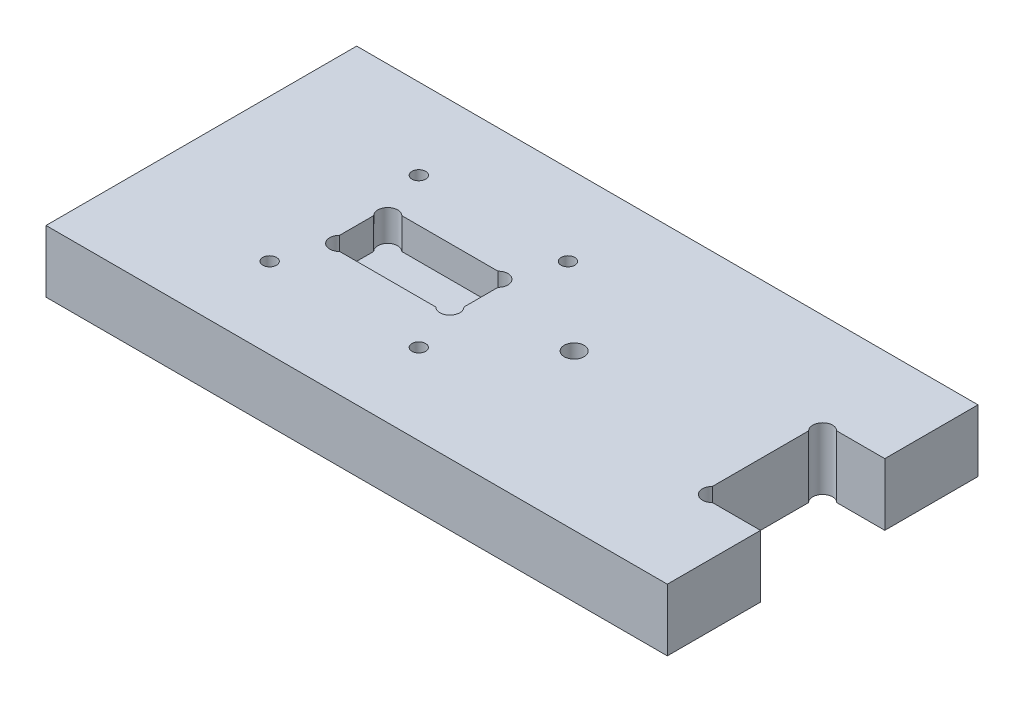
SolidWorks part; units mm, degrees
ref_plane "Plan de face" through (0, 0, 0) normal (0, 0, 1) x (1, 0, 0)
ref_plane "Plan de dessus" through (0, 0, 0) normal (0, 1, 0) x (1, 0, 0)
ref_plane "Plan de droite" through (0, 0, 0) normal (1, 0, 0) x (0, 0, -1)
sketch "Esquisse1" plane through (0, 0, 0) normal (0, 1, 0) x (1, 0, 0)
  line L0 (-29.0426, 0) -> (126.9149, 0) construction
  line L1 (0, -5.4255) -> (0, 79.2553) construction
  line L2 (-29.0426, 50) -> (126.9149, 50) construction
  line L3 (100, -5.4255) -> (100, 82.0213) construction
  line L4 (50, 70.3191) -> (50, 63.232) construction
  line L5 (-20.5319, 25) -> (71.7306, 25) construction
  line L6 (84.5024, 35) -> (116.1219, 35) construction
  line L7 (60, -5.4255) -> (60, 28.5588) construction
  line L8 (90, 67.7571) -> (90, -15.7213) construction
  line L9 (47, -15.7213) -> (47, 45.1283) construction
  line L10 (23, -15.7213) -> (23, 45.1283) construction
  line L11 (0, 50) -> (0, 0)
  line L12 (35, -5.4255) -> (35, 31.9737) construction
  line L13 (100, 35) -> (100, 50)
  line L14 (92.2627, 35) -> (100, 35)
  line L15 (0, 50) -> (100, 50)
  line L16 (0, 0) -> (100, 0)
  line L17 (92.2627, 15) -> (100, 15)
  line L18 (100, 15) -> (100, 0)
  line L19 (-5.892, 13) -> (50, 13) construction
  line L21 (90, 32.7373) -> (90, 17.2627)
  circle A0 centre (23, 13) radius 1.1
  circle A1 centre (47, 13) radius 1.1
  arc A2 (90, 17.2627) -> (92.2627, 15) centre (91.1314, 16.1314) ccw
  arc A3 (90, 32.7373) -> (92.2627, 35) centre (91.1314, 33.8686) cw
  circle A4 centre (47, 37) radius 1.1
  circle A5 centre (23, 37) radius 1.1
  circle A6 centre (60, 25) radius 1.6
  dimension "D10" = 12
  dimension "D1" = 25
  dimension "D2" = 50
  dimension "D3" = 100
  dimension "D4" = 50
  dimension "D5" = 10
  dimension "D6" = 15
  dimension "D7" = 43
  dimension "D8" = 24
  dimension "D9" = 13
  dimension "D11" = 12
extrude "Boss.-Extru.1" add sketch "Esquisse1" along normal blind 10
sketch "Esquisse2" plane through (0, 10, 0) normal (0, 1, 0) x (1, 0, 0)
  line L0 (90, 25) -> (10.3628, 25) construction
  line L1 (90, 15.5114) -> (90, 62.7354) construction
  line L2 (35, 55.2919) -> (35, 21.0026) construction
  line L3 (10.3628, 20) -> (52.0347, 20) construction
  line L4 (10.3628, 30) -> (52.0347, 30) construction
  line L5 (45, 62.7354) -> (45, 13.8031) construction
  line L6 (25, 62.7354) -> (25, 13.8031) construction
  line L7 (25, 30) -> (38.5802, 16.4198) construction
  line L8 (90, 17.2627) -> (90, 32.7373) construction
  line L9 (25, 27.7373) -> (25, 22.2627)
  line L10 (27.2627, 30) -> (42.7373, 30)
  line L11 (45, 27.7373) -> (45, 22.2627)
  line L12 (27.2627, 20) -> (42.7373, 20)
  arc A0 (27.2627, 30) -> (25, 27.7373) centre (26.1314, 28.8686) ccw
  arc A1 (42.7373, 30) -> (45, 27.7373) centre (43.8686, 28.8686) cw
  arc A2 (42.7373, 20) -> (45, 22.2627) centre (43.8686, 21.1314) ccw
  arc A3 (27.2627, 20) -> (25, 22.2627) centre (26.1314, 21.1314) cw
  dimension "D1" = 5
  dimension "D2" = 5
  dimension "D3" = 20
  dimension "D4" = 10
  dimension "D5" = 45
  dimension "D6" = 45
extrude "Enlèv. mat.-Extru.1" cut sketch "Esquisse2" against normal blind 5
